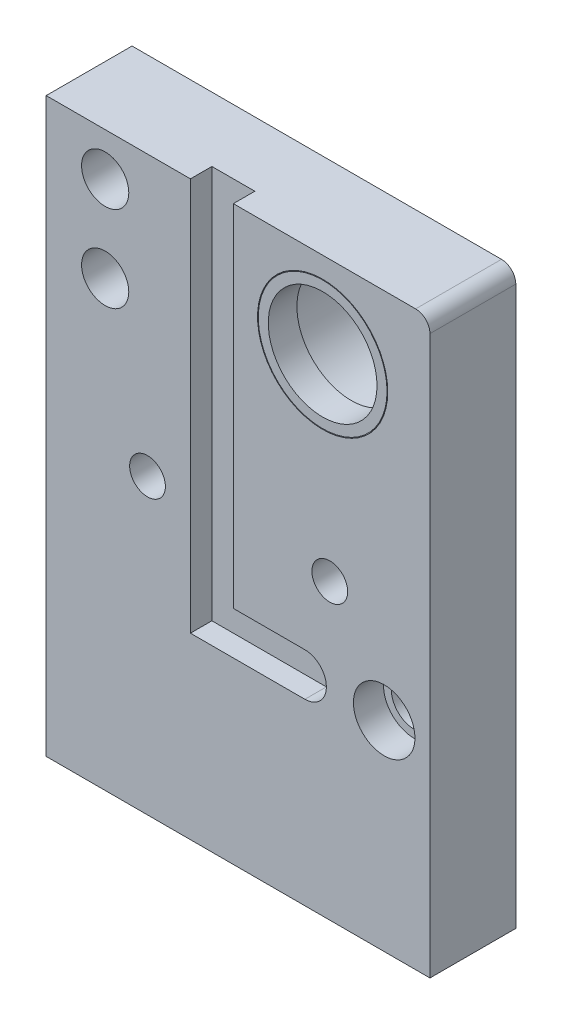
SolidWorks part; units mm, degrees
ref_plane "Front Plane" through (0, 0, 0) normal (0, 0, 1) x (1, 0, 0)
ref_plane "Top Plane" through (0, 0, 0) normal (0, 1, 0) x (1, 0, 0)
ref_plane "Right Plane" through (0, 0, 0) normal (1, 0, 0) x (0, 0, -1)
sketch "Sketch1" plane through (0, 0, 0) normal (0, 0, 1) x (1, 0, 0)
  line L1 (0, 0) -> (26.8206, 0)
  line L2 (0, 0) -> (0, 40)
  line L3 (0, 40) -> (26.8206, 40)
  line L4 (26.8206, 0) -> (26.8206, 40)
  circle A0 centre (19.3206, 34) radius 4.55
  circle A1 centre (23.6206, 14) radius 1.6
  circle A2 centre (4.1218, 37) radius 1.25 construction
  circle A3 centre (4.1218, 37) radius 1.25 construction
  circle A4 centre (4.1218, 31) radius 1.25 construction
  circle A5 centre (4.1218, 31) radius 1.25 construction
  circle A6 centre (4.1218, 31) radius 1.65
  circle A7 centre (4.1218, 37) radius 1.65
  dimension "D3" = 7.5
  dimension "D4" = 9.1
  dimension "D6" = 3.2
  dimension "D7" = 3.2
  dimension "D9" = 3.3
  dimension "D1" = 40
  dimension "D2" = 26.8206
  dimension "D5" = 6
  dimension "D8" = 14
extrude "Boss-Extrude1" add sketch "Sketch1" along normal blind 6
fillet "Fillet1" radius 1 1 edges at (26.8206, 40, 3)
sketch "Sketch3" plane through (0, 0, 6) normal (0, 0, 1) x (1, 0, 0)
  circle A0 centre (19.3206, 34) radius 4.5
  circle A1 centre (19.3206, 34) radius 3.8
  dimension "D1" = 9
  dimension "D2" = 7.6
extrude "Boss-Extrude2" add sketch "Sketch3" against normal blind 2
sketch "Sketch4" plane through (0, 0, 0) normal (0, -1, 0) x (1, 0, 0)
  line L0 (0, 6) -> (0, 0) construction
  circle A0 centre (3, 3) radius 1.3
  circle A1 centre (11.6, 3) radius 1.3
  point P4 (0, 3)
  dimension "D2" = 2.6
  dimension "D3" = 3
  dimension "D1" = 8.6
extrude "Cut-Extrude1" cut sketch "Sketch4" against normal blind 8
sketch "Sketch5" plane through (0, 0, 6) normal (0, 0, 1) x (1, 0, 0)
  circle A0 centre (23.6206, 14) radius 2.15
  dimension "D1" = 4.3
extrude "Cut-Extrude2" cut sketch "Sketch5" against normal blind 2.1
sketch "Sketch6" plane through (0, 0, 6) normal (0, 0, 1) x (1, 0, 0)
  line L8 (13.0803, 15.5) -> (19.5803, 15.5)
  line L9 (10.0803, 12.5) -> (19.5803, 12.5)
  line L10 (22.0803, 15.5) -> (25.1609, 15.5) construction
  line L11 (22.0803, 12.5) -> (25.1609, 12.5) construction
  line L12 (10.0803, 12.5) -> (10.0803, 40)
  line L13 (25.8206, 40) -> (0, 40) construction
  line L14 (13.0803, 15.5) -> (13.0803, 40)
  line L15 (13.0803, 40) -> (10.0803, 40)
  line L16 (19.5803, 15.5) -> (19.5803, 12.5)
  circle A0 centre (23.6206, 14) radius 2.15 construction
  dimension "D5" = 3
  dimension "D6" = 3
  dimension "D7" = 9
  dimension "D8" = 2.5
extrude "Cut-Extrude3" cut sketch "Sketch6" against normal blind 1.5
fillet "Fillet2" radius 1.5 2 edges at (19.5803, 12.5, 5.25) (19.5803, 15.5, 5.25)
sketch "Sketch7" plane through (0, 0, 6) normal (0, 0, 1) x (1, 0, 0)
  line L0 (0, 20.5) -> (26.8206, 20.5) construction
  line L1 (26.8206, 0) -> (26.8206, 39) construction
  line L2 (0, 40) -> (0, 0) construction
  line L3 (10.0803, 40) -> (10.0803, 12.5) construction
  line L4 (0, 0) -> (26.8206, 0) construction
  circle A0 centre (7.0803, 20.5) radius 1.25
  circle A1 centre (19.8206, 20.5) radius 1.25
  dimension "D1" = 2.5
  dimension "D3" = 3
  dimension "D2" = 7
  dimension "D4" = 20.5
extrude "Cut-Extrude4" cut sketch "Sketch7" against normal blind 10
